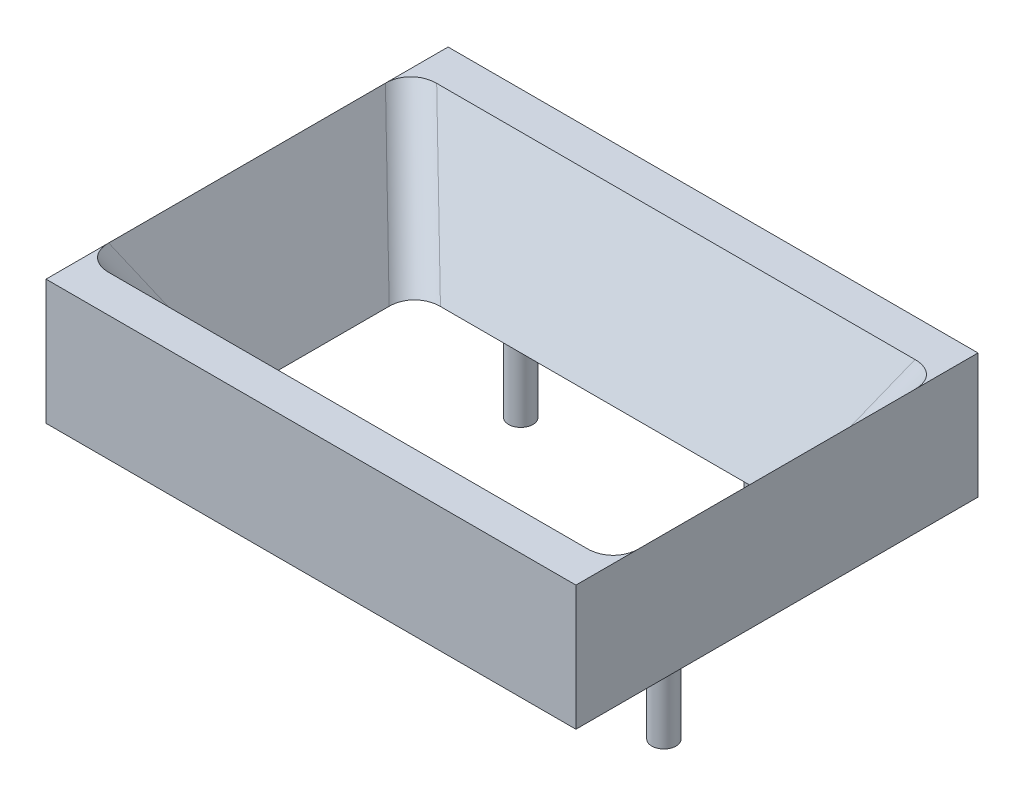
SolidWorks part; units mm, degrees
ref_plane "Front Plane" through (0, 0, 0) normal (0, 0, 1) x (1, 0, 0)
ref_plane "Top Plane" through (0, 0, 0) normal (0, 1, 0) x (1, 0, 0)
ref_plane "Right Plane" through (0, 0, 0) normal (1, 0, 0) x (0, 0, -1)
sketch "Sketch1" plane through (0, 0, 0) normal (0, 1, 0) x (1, 0, 0)
  line L1 (-69.1261, -52.451) -> (69.1261, -52.451)
  line L2 (-69.1261, -52.451) -> (-69.1261, 52.451)
  line L3 (-69.1261, 52.451) -> (69.1261, 52.451)
  line L4 (69.1261, -52.451) -> (69.1261, 52.451)
  line L5 (-69.1261, -52.451) -> (69.1261, 52.451) construction
  line L6 (-69.1261, 52.451) -> (69.1261, -52.451) construction
  point P0 (0, 0)
extrude "Boss-Extrude1" add sketch "Sketch1" along normal blind 50.8
other "Cavity2"
other "Plinko_Lower_Funnel_negative<1>@Funnel_Assem2"
sketch "Sketch2" plane through (0, 0, 0) normal (0, -1, 0) x (1, 0, 0)
  circle A0 centre (-31.3718, -33.655) radius 3.937 construction
  circle A1 centre (-31.3718, -33.655) radius 3.937 construction
  circle A2 centre (31.3718, -33.655) radius 3.937 construction
  circle A3 centre (31.3718, -33.655) radius 3.937 construction
  circle A5 centre (-59.963, 20.33) radius 3.937 construction
  circle A6 centre (-59.963, 20.33) radius 3.937 construction
  circle A7 centre (59.9631, 20.33) radius 3.937 construction
  circle A8 centre (59.9631, 20.33) radius 3.937 construction
  circle A9 centre (-59.963, 20.33) radius 3.175
  circle A10 centre (59.9631, 20.33) radius 3.175
  circle A11 centre (31.3718, -33.655) radius 3.175
  circle A12 centre (-31.3718, -33.655) radius 3.175
  dimension "D1" = 0.762
extrude "Boss-Extrude3" add sketch "Sketch2" along normal offset from surface (22.86 mm away) 2.54
sketch "Sketch3" plane through (69.1261, 0, 0) normal (1, 0, 0) x (0, 0, -1)
  line L0 (-52.451, 50.8) -> (-52.451, 0) construction
  line L1 (-52.451, 32.5797) -> (52.451, 32.5797)
  line L2 (-52.451, 32.5797) -> (-52.451, 50.8)
  line L3 (-52.451, 50.8) -> (52.451, 50.8)
  line L4 (52.451, 32.5797) -> (52.451, 50.8)
  line L5 (52.451, 50.8) -> (52.451, 0) construction
  line L6 (36.105, 32.5797) -> (-36.105, 32.5797) construction
  point P10 (52.451, 45.091)
extrude "Cut-Extrude1" cut sketch "Sketch3" against normal through all
equation "\"D1@Sketch1\"=4.13"
